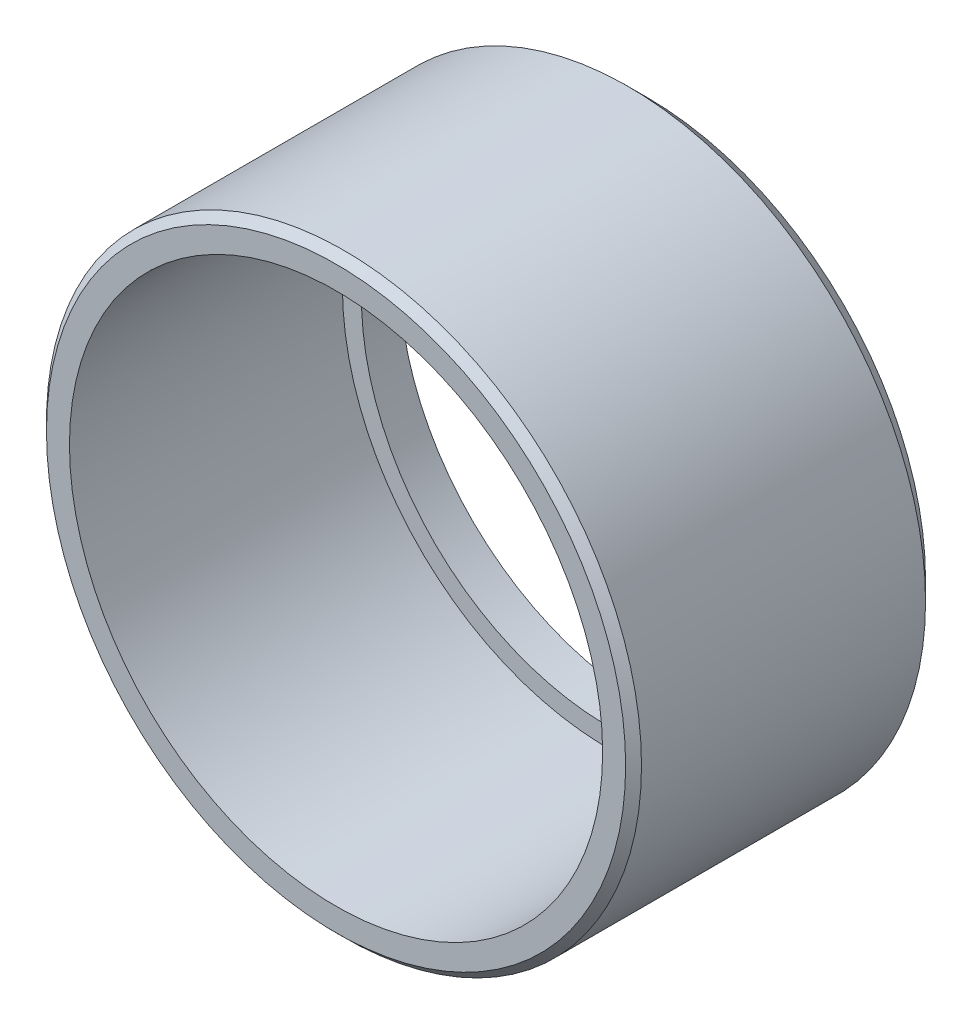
SolidWorks part; units mm, degrees
ref_plane "Front Plane" through (0, 0, 0) normal (0, 0, 1) x (1, 0, 0)
ref_plane "Top Plane" through (0, 0, 0) normal (0, 1, 0) x (1, 0, 0)
ref_plane "Right Plane" through (0, 0, 0) normal (1, 0, 0) x (0, 0, -1)
sketch "Sketch1" plane through (0, 0, 0) normal (0, 0, 1) x (1, 0, 0)
  circle A0 centre (0, 0) radius 47.625
  circle A1 centre (0, 0) radius 39.624
extrude "Extrude1" add sketch "Sketch1" along normal blind 49.784
sketch "Sketch2" plane through (0, 0, 49.784) normal (0, 0, 1) x (1, 0, 0)
  circle A0 centre (0, 0) radius 42.672
extrude "Extrude2" cut sketch "Sketch2" against normal blind 43.688
chamfer "Chamfer1" distance 3.048 angle 45 1 edges at (47.625, 0, 0)
chamfer "Chamfer2" distance 1.27 angle 45 1 edges at (47.625, 0, 49.784)
